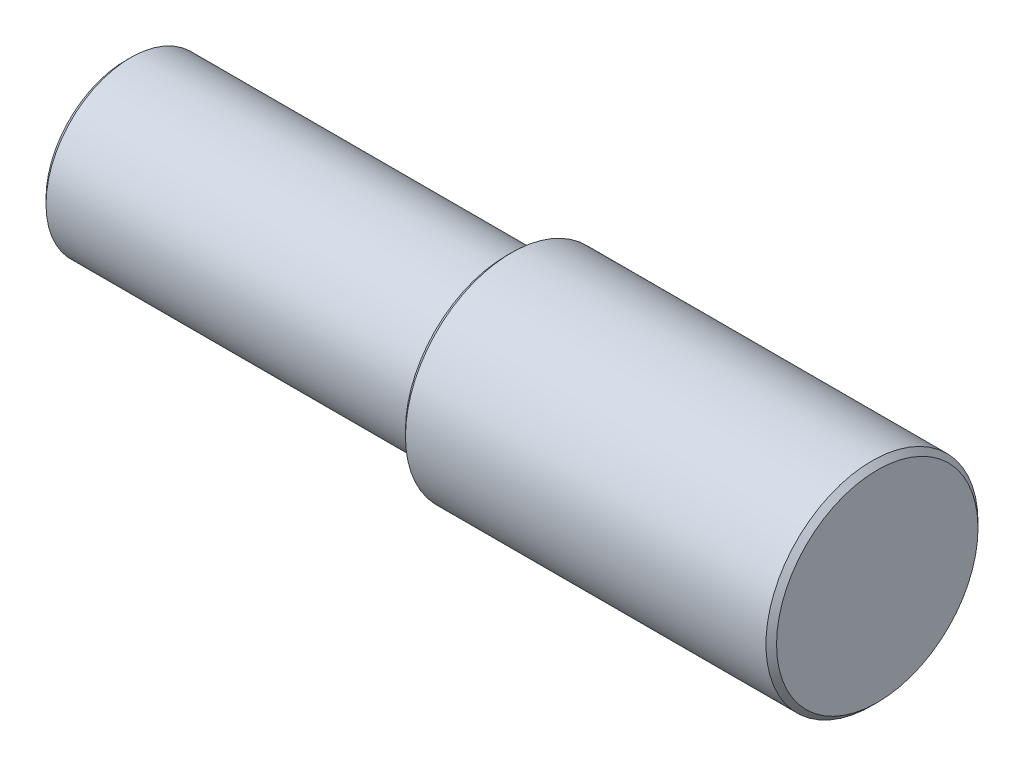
SolidWorks part; units mm, degrees
ref_plane "Front Plane" through (0, 0, 0) normal (0, 0, 1) x (1, 0, 0)
ref_plane "Top Plane" through (0, 0, 0) normal (0, 1, 0) x (1, 0, 0)
ref_plane "Right Plane" through (0, 0, 0) normal (1, 0, 0) x (0, 0, -1)
sketch "Sketch1" plane through (0, 0, 0) normal (0, 0, 1) x (1, 0, 0)
  line L0 (-35, 10) -> (-35, 0)
  line L1 (-35, 0) -> (0, 0)
  line L2 (0, 0) -> (0, 10)
  line L3 (0, 10) -> (-35, 10)
  line L4 (-35, 0) -> (0, 0) construction
  dimension "D1" = 35
  dimension "D2" = 10
revolve "Revolve1" add sketch "Sketch1" angle 360 about L4
sketch "Sketch2" plane through (-35, 0, 0) normal (-1, 0, 0) x (0, 0, 1)
  circle A0 centre (0, 0) radius 8
  dimension "D1" = 16
extrude "Boss-Extrude1" add sketch "Sketch2" along normal blind 35.9
ref_plane "Plane1" through (0, 0, -5) normal (0, 0, 1) x (1, 0, 0)
sketch "Sketch3" plane through (0, 0, -5) normal (0, 0, 1) x (1, 0, 0)
  line L0 (-40.45, 2.5) -> (-65.45, 2.5)
  line L1 (-65.45, -2.5) -> (-40.45, -2.5)
  arc A0 (-65.45, 2.5) -> (-65.45, -2.5) centre (-65.45, 0) ccw
  arc A1 (-40.45, -2.5) -> (-40.45, 2.5) centre (-40.45, 0) ccw
  dimension "D1" = 2.5
  dimension "D2" = 25
hole_wizard "M6x1.0 Tapped Hole1" positions "Sketch5" profile "Sketch4" tap size "M6x1.0" standard "ANSI Metric"
sketch "Sketch5" plane through (-70.9, 0, 0) normal (-1, 0, 0) x (0, 0, 1)
  point P0 (0, 0)
sketch "Sketch4" plane through (-70.9, 0, 0) normal (0, 1, 0) x (0, 0, 1)
  line L0 (0, 0) -> (0, 27.5022)
  line L1 (0, 27.5022) -> (2.5, 26)
  line L2 (2.5, 26) -> (2.5, 0)
  line L5 (2.5, 0) -> (0, 0)
  line L10 (0, 27.5022) -> (-2.5, 26) construction
  line L11 (0, -6.35) -> (0, 107.95) construction
  dimension "Tap Drill Dia." = 5
  dimension "Tap Drill Depth" = 26
  dimension "Drill Angle" = 118
chamfer "Chamfer1" distance 0.5 angle 45 4 edges at (0, 0, -10) (-35, 0, -10) (-70.9, 0, 2.5) (-70.9, 0, 8)
extrude "Cut-Extrude2" cut sketch "Sketch3" against normal blind 10
